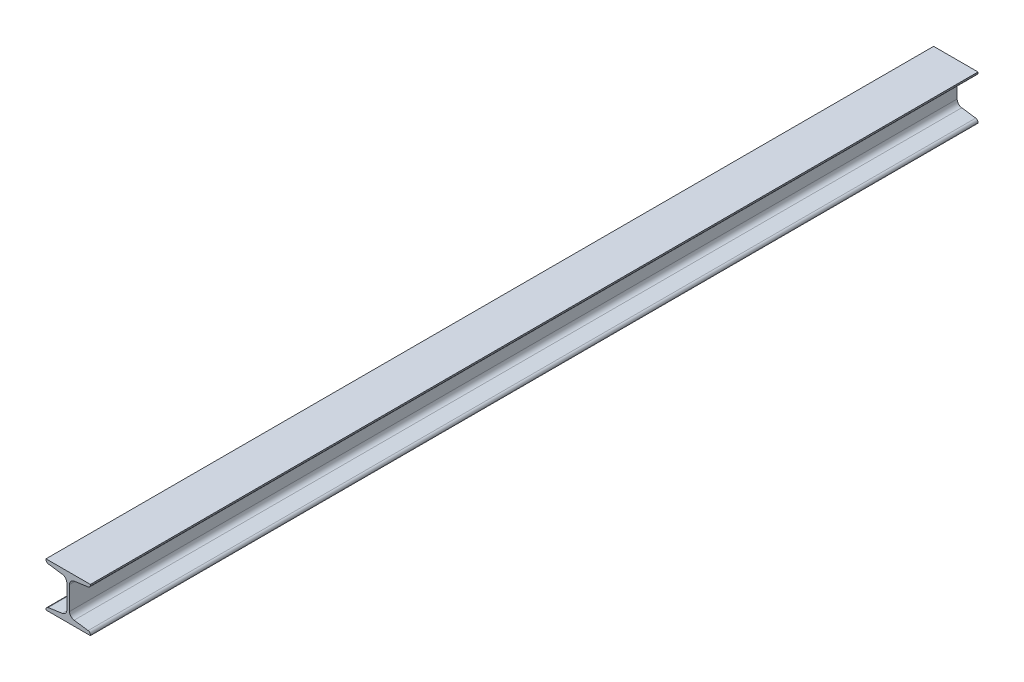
SolidWorks part; units mm, degrees
ref_plane "Alzado" through (0, 0, 0) normal (0, 0, 1) x (1, 0, 0)
ref_plane "Planta" through (0, 0, 0) normal (0, 1, 0) x (1, 0, 0)
ref_plane "Vista lateral" through (0, 0, 0) normal (1, 0, 0) x (0, 0, -1)
sketch "Croquis1" plane through (0, 0, 0) normal (0, 0, 1) x (1, 0, 0)
  line L0 (51.713, 0) -> (51.713, 1.4816)
  line L1 (56.878, 7.4232) -> (88.3831, 11.8509)
  line L2 (98.713, 23.7342) -> (98.713, 76.2658)
  line L3 (88.3831, 88.1491) -> (56.878, 92.5768)
  line L4 (51.713, 98.5184) -> (51.713, 100)
  line L5 (51.713, 100) -> (151.713, 100)
  line L6 (151.713, 100) -> (151.713, 98.5184)
  line L7 (146.548, 92.5768) -> (115.0429, 88.1491)
  line L8 (104.713, 76.2658) -> (104.713, 23.7342)
  line L9 (115.0429, 11.8509) -> (146.548, 7.4232)
  line L10 (151.713, 1.4816) -> (151.713, 0)
  line L11 (151.713, 0) -> (51.713, 0)
  line L14 (-37.938, 22.098) -> (-56.988, 22.098) construction
  arc A0 (88.3831, 11.8509) -> (98.713, 23.7342) centre (86.713, 23.7342) ccw
  arc A1 (98.713, 76.2658) -> (88.3831, 88.1491) centre (86.713, 76.2658) ccw
  arc A2 (115.0429, 88.1491) -> (104.713, 76.2658) centre (116.713, 76.2658) ccw
  arc A3 (104.713, 23.7342) -> (115.0429, 11.8509) centre (116.713, 23.7342) ccw
  arc A4 (51.713, 98.5184) -> (56.878, 92.5768) centre (57.713, 98.5184) ccw
  arc A5 (151.713, 98.5184) -> (146.548, 92.5768) centre (145.713, 98.5184) cw
  arc A6 (151.713, 1.4816) -> (146.548, 7.4232) centre (145.713, 1.4816) ccw
  arc A7 (51.713, 1.4816) -> (56.878, 7.4232) centre (57.713, 1.4816) cw
  point P0 (101.473, 304.8)
extrude "Extruir1" add sketch "Croquis1" along normal blind 2000
